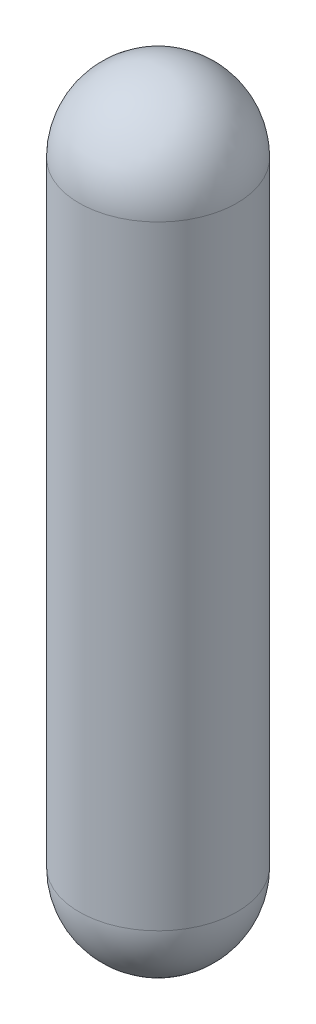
SolidWorks part; units mm, degrees
ref_plane "Front Plane" through (0, 0, 0) normal (0, 0, 1) x (1, 0, 0)
ref_plane "Top Plane" through (0, 0, 0) normal (0, 1, 0) x (1, 0, 0)
ref_plane "Right Plane" through (0, 0, 0) normal (1, 0, 0) x (0, 0, -1)
sketch "Sketch1" plane through (0, 0, 0) normal (0, 1, 0) x (1, 0, 0)
  circle A0 centre (0, 0) radius 57.15
  dimension "D1" = 114.3
extrude "Boss-Extrude1" add sketch "Sketch1" along normal blind 558.8
fillet "Fillet1" radius 57.15 2 edges at (0, 0, 57.15) (0, 558.8, 57.15)
